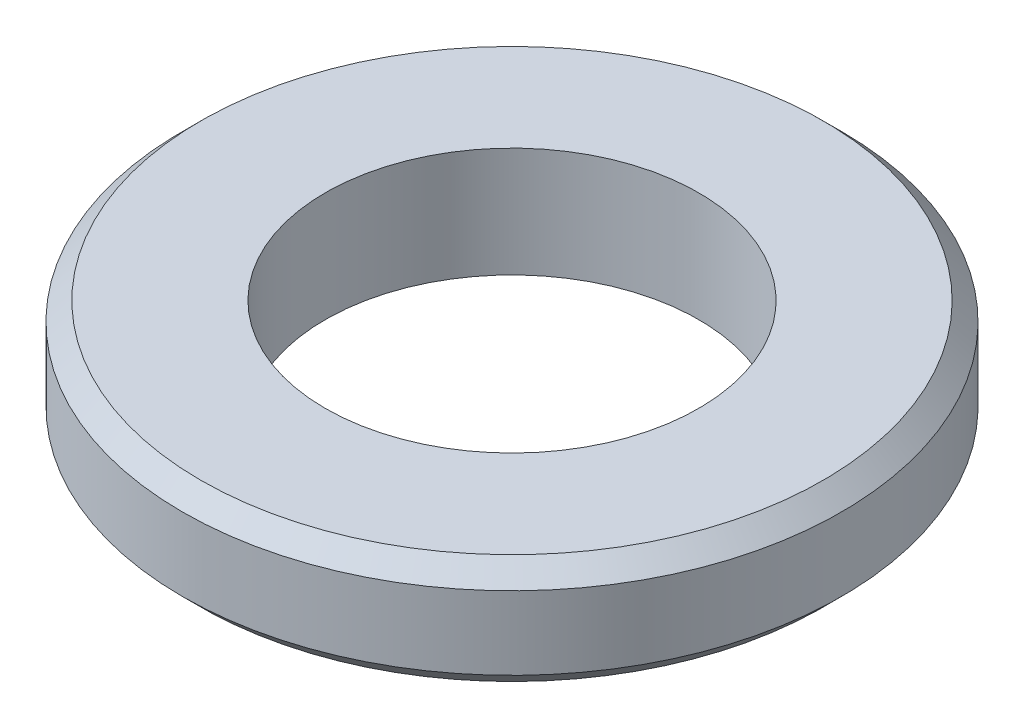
SolidWorks part; units mm, degrees
ref_plane "Plan de face" through (0, 0, 0) normal (0, 0, 1) x (1, 0, 0)
ref_plane "Plan de dessus" through (0, 0, 0) normal (0, 1, 0) x (1, 0, 0)
ref_plane "Plan de droite" through (0, 0, 0) normal (1, 0, 0) x (0, 0, -1)
sketch "Esquisse1" plane through (0, 0, 0) normal (0, 0, 1) x (1, 0, 0)
  line L0 (0, 6.5369) -> (0, -10.1626) construction
  line L1 (-9, -0.1113) -> (0, -0.1113)
  line L2 (-9, -0.1113) -> (-9, -3.1113)
  line L3 (-9, -3.1113) -> (0, -3.1113)
  line L4 (0, -3.1113) -> (0, -0.1113)
  dimension "D1" = 9
  dimension "D2" = 3
revolve "Révolution1" add sketch "Esquisse1" angle 360 about L0
hole_wizard "Trou taraudé M121" positions "Esquisse5" profile "Esquisse4" tap size "M12" standard "ISO"
sketch "Esquisse5" plane through (0, -0.1113, 0) normal (0, 1, 0) x (-1, 0, 0)
  point P0 (0, 0)
sketch "Esquisse4" plane through (0, -0.1113, 0) normal (1, 0, 0) x (0, 0, 1)
  line L0 (0, 0) -> (0, 3)
  line L1 (0, 3) -> (5.1, 3)
  line L2 (5.1, 3) -> (5.1, 0)
  line L5 (5.1, 0) -> (0, 0)
  line L11 (0, -6.35) -> (0, 107.95) construction
  dimension "Diamètre du trou pour taraudage jusqu'au prochain" = 10.2
  dimension "Profondeur du trou pour taraudage jusqu'au prochain" = 3
chamfer "Chanfrein1" distance 0.5 angle 45 2 edges at (0, -3.1113, 9) (0, -0.1113, 9)
